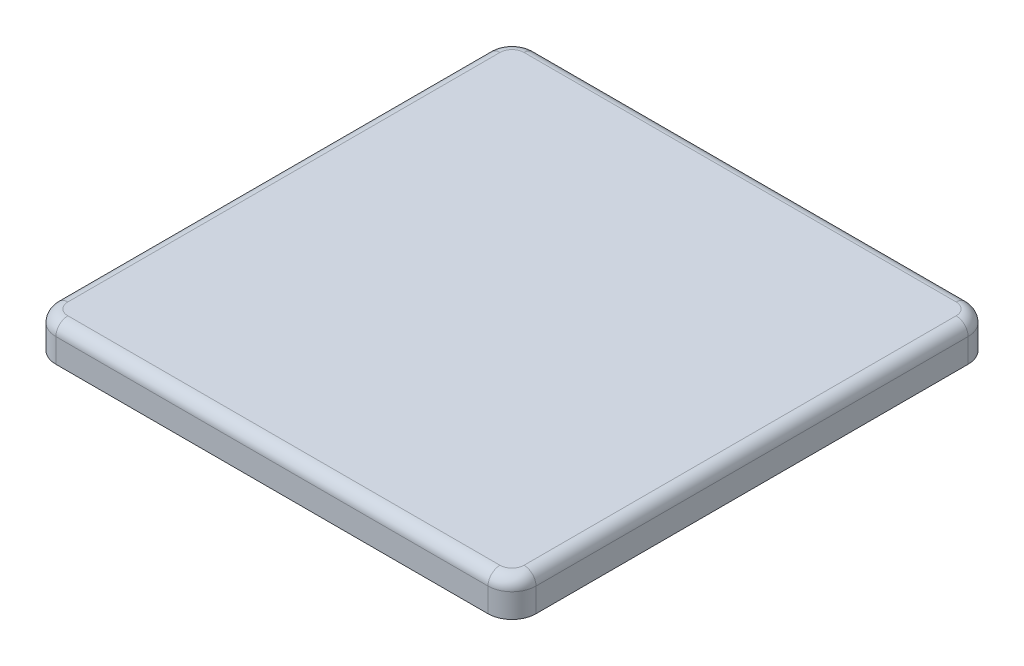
SolidWorks part; units mm, degrees
ref_plane "正面" through (0, 0, 0) normal (0, 0, 1) x (1, 0, 0)
ref_plane "平面" through (0, 0, 0) normal (0, 1, 0) x (1, 0, 0)
ref_plane "右側面" through (0, 0, 0) normal (1, 0, 0) x (0, 0, -1)
sketch "ｽｹｯﾁ1" plane through (0, 0, 0) normal (0, 1, 0) x (0, 0, -1)
  line L1 (-18, 20) -> (18, 20)
  line L2 (-20, 18) -> (-20, -18)
  line L3 (-18, -20) -> (18, -20)
  line L4 (20, 18) -> (20, -18)
  arc A0 (20, 18) -> (18, 20) centre (18, 18) ccw
  arc A1 (18, -20) -> (20, -18) centre (18, -18) ccw
  arc A2 (-20, -18) -> (-18, -20) centre (-18, -18) ccw
  arc A3 (-18, 20) -> (-20, 18) centre (-18, 18) ccw
  point P7 (20, 20)
  point P10 (20, -20)
  point P15 (-20, 20)
  dimension "D5" = 2
  dimension "D1" = 20
  dimension "D2" = 40
  dimension "D3" = 20
  dimension "D4" = 40
extrude "押し出し1" add sketch "ｽｹｯﾁ1" along normal mid plane 3
fillet "ﾌｨﾚｯﾄ1" radius 1 8 edges at (-19.4142, 1.5, 19.4142) (-20, 1.5, 0) (-19.4142, 1.5, -19.4142) (0, 1.5, -20) (19.4142, 1.5, -19.4142) (20, 1.5, 0) (19.4142, 1.5, 19.4142) (0, 1.5, 20)
sketch "ｽｹｯﾁ2" plane through (0, -1.5, 0) normal (0, -1, 0) x (1, 0, 0)
  line L1 (-18, 18.8) -> (18, 18.8)
  line L2 (-18.8, 18) -> (-18.8, -18)
  line L3 (-18, -18.8) -> (18, -18.8)
  line L4 (18.8, 18) -> (18.8, -18)
  arc A0 (-18, 18.8) -> (-18.8, 18) centre (-18, 18) ccw
  arc A1 (18.8, 18) -> (18, 18.8) centre (18, 18) ccw
  arc A2 (18, -18.8) -> (18.8, -18) centre (18, -18) ccw
  arc A3 (-18.8, -18) -> (-18, -18.8) centre (-18, -18) ccw
  point P7 (-18.8, 18.8)
  point P10 (18.8, 18.8)
  point P13 (18.8, -18.8)
  dimension "D5" = 0.8
  dimension "D1" = 18.8
  dimension "D2" = 37.6
  dimension "D3" = 18.8
  dimension "D4" = 37.6
extrude "押し出し2" cut sketch "ｽｹｯﾁ2" against normal blind 1
sketch "ｽｹｯﾁ4" plane through (0, -0.5, 0) normal (0, -1, 0) x (1, 0, 0)
  line L1 (-11.35, 12.1) -> (-8.65, 12.1)
  line L2 (-11.35, 12.1) -> (-11.35, 7.9)
  line L3 (-11.35, 7.9) -> (-8.65, 7.9)
  line L4 (-8.65, 12.1) -> (-8.65, 7.9)
  line L5 (-20, -18) -> (-20, 18) construction
  line L6 (-18, 20) -> (18, 20) construction
  line L7 (20, 18) -> (20, -18) construction
  line L8 (8.65, 12.1) -> (11.35, 12.1)
  line L9 (8.65, 12.1) -> (8.65, 7.9)
  line L10 (8.65, 7.9) -> (11.35, 7.9)
  line L11 (11.35, 12.1) -> (11.35, 7.9)
  line L12 (-11.35, -7.9) -> (-8.65, -7.9)
  line L13 (-11.35, -7.9) -> (-11.35, -12.1)
  line L14 (-11.35, -12.1) -> (-8.65, -12.1)
  line L15 (-8.65, -7.9) -> (-8.65, -12.1)
  line L16 (8.65, -7.9) -> (11.35, -7.9)
  line L17 (8.65, -7.9) -> (8.65, -12.1)
  line L18 (8.65, -12.1) -> (11.35, -12.1)
  line L19 (11.35, -7.9) -> (11.35, -12.1)
  line L20 (18, -20) -> (-18, -20) construction
  dimension "D1" = 2.7
  dimension "D2" = 4.2
  dimension "D3" = 8.65
  dimension "D4" = 7.9
  dimension "D5" = 2.7
  dimension "D6" = 8.65
  dimension "D7" = 7.9
  dimension "D8" = 4.2
extrude "押し出し4" add sketch "ｽｹｯﾁ4" along normal blind 7
fillet "ﾌｨﾚｯﾄ2" radius 1 16 edges at (-10, -7.5, 12.1) (-8.65, -7.5, 10) (-10, -7.5, 7.9) (-11.35, -7.5, 10) (-10, -7.5, -7.9) (-8.65, -7.5, -10) (-10, -7.5, -12.1) (-11.35, -7.5, -10) (10, -7.5, -7.9) (11.35, -7.5, -10) (10, -7.5, -12.1) (8.65, -7.5, -10) (10, -7.5, 12.1) (11.35, -7.5, 10) (10, -7.5, 7.9) (8.65, -7.5, 10)
